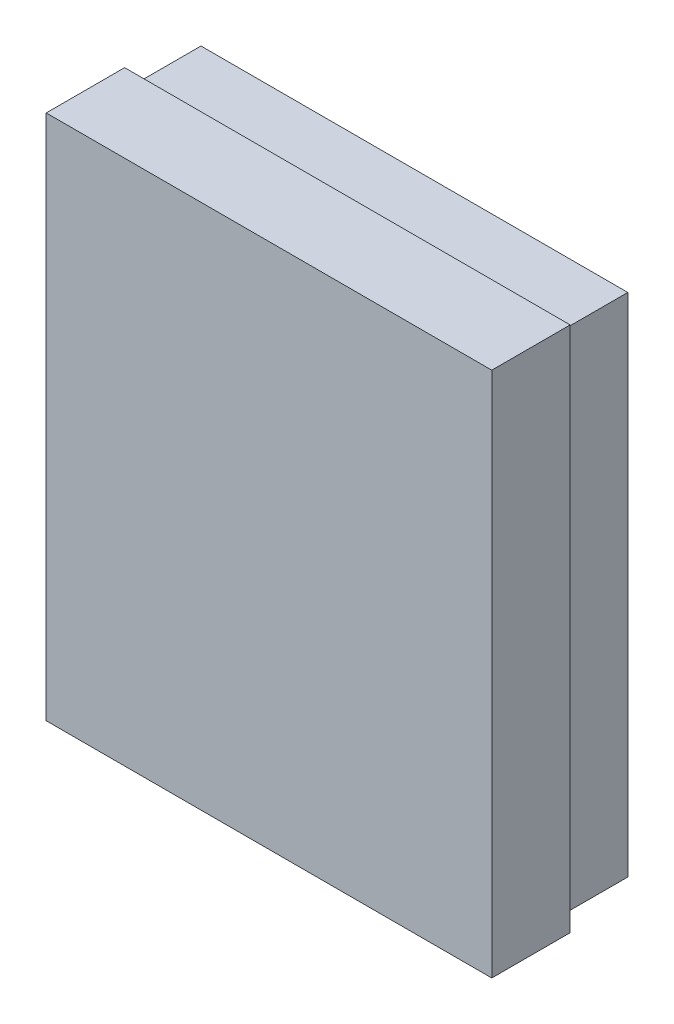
SolidWorks part; units mm, degrees
ref_plane "Front Plane" through (0, 0, 0) normal (0, 0, 1) x (1, 0, 0)
ref_plane "Top Plane" through (0, 0, 0) normal (0, 1, 0) x (1, 0, 0)
ref_plane "Right Plane" through (0, 0, 0) normal (1, 0, 0) x (0, 0, -1)
sketch "Sketch1" plane through (0, 0, 0) normal (0, 0, 1) x (1, 0, 0)
  line L1 (-9.5799, 14.954) -> (11.2989, 14.954)
  line L2 (-9.5799, 14.954) -> (-9.5799, -9.811)
  line L3 (-9.5799, -9.811) -> (11.2989, -9.811)
  line L4 (11.2989, 14.954) -> (11.2989, -9.811)
  dimension "D1" = 20.8788
  dimension "D2" = 24.765
extrude "Extrude1" add sketch "Sketch1" along normal blind 3.2766
sketch "Sketch2" plane through (0, 0, 3.2766) normal (0, 0, 1) x (1, 0, 0)
  line L0 (0.8595, 14.954) -> (0.8595, -9.811) construction
  line L1 (-10.0378, 15.4463) -> (11.7568, 15.4463)
  line L2 (-10.0378, 15.4463) -> (-10.0378, -10.3033)
  line L3 (-10.0378, -10.3033) -> (11.7568, -10.3033)
  line L4 (11.7568, 15.4463) -> (11.7568, -10.3033)
  line L5 (11.2989, 14.954) -> (-9.5799, 14.954) construction
  line L6 (-9.5799, -9.811) -> (11.2989, -9.811) construction
  line L7 (-9.5799, 2.5715) -> (11.7568, 2.5715) construction
  line L8 (0.8595, 15.4463) -> (0.8595, -10.3033) construction
  line L9 (-9.5799, 14.954) -> (-9.5799, -9.811) construction
extrude "Extrude2" add sketch "Sketch2" along normal blind 3.8354
sketch "Sketch3" plane through (-10.0378, 0, 0) normal (-1, 0, 0) x (0, 0, 1)
  line L1 (6.5646, 14.7073) -> (1.9672, 14.7073)
  line L2 (6.5646, 14.7073) -> (6.5646, 7.6084)
  line L3 (6.5646, 7.6084) -> (1.9672, 7.6084)
  line L4 (1.9672, 14.7073) -> (1.9672, 7.6084)
extrude "Cut-Extrude1" cut sketch "Sketch3" against normal blind 0.809
